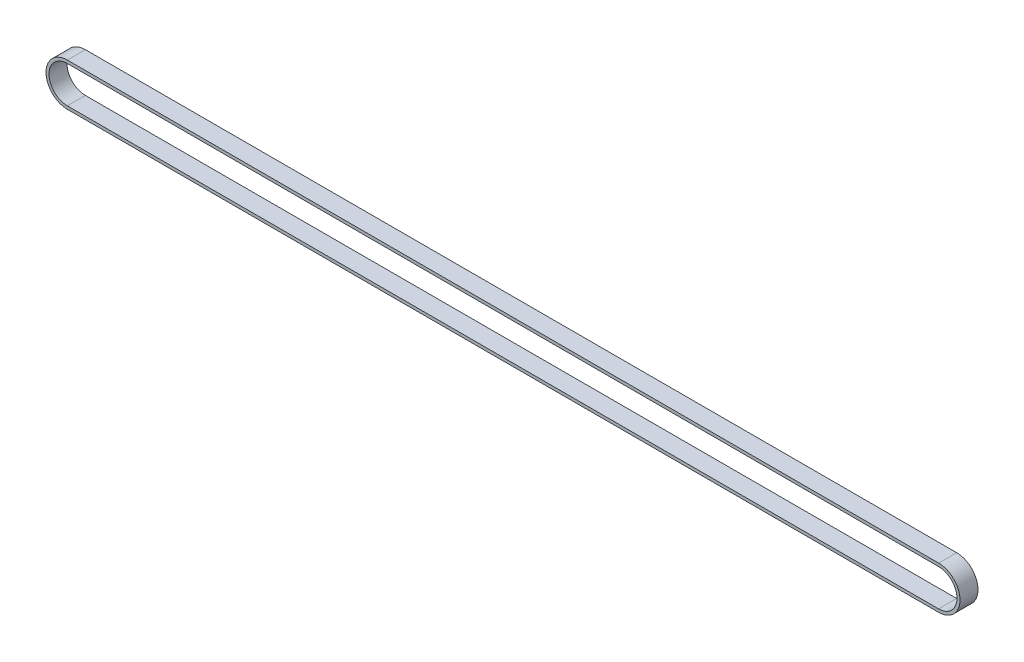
SolidWorks part; units mm, degrees
ref_plane "Спереди" through (0, 0, 0) normal (0, 0, 1) x (1, 0, 0)
ref_plane "Сверху" through (0, 0, 0) normal (0, 1, 0) x (1, 0, 0)
ref_plane "Справа" through (0, 0, 0) normal (1, 0, 0) x (0, 0, -1)
sketch "Эскиз1" plane through (0, 0, 0) normal (0, 0, 1) x (1, 0, 0)
  line L0 (0, 6.1) -> (290, 6.1)
  line L1 (0, -6.1) -> (290, -6.1)
  line L2 (0, 7.1) -> (290, 7.1)
  line L3 (0, -7.1) -> (290, -7.1)
  arc A0 (0, 6.1) -> (0, -6.1) centre (0, 0) ccw
  arc A1 (290, -6.1) -> (290, 6.1) centre (290, 0) ccw
  arc A2 (290, -7.1) -> (290, 7.1) centre (290, 0) ccw
  arc A3 (0, 7.1) -> (0, -7.1) centre (0, 0) ccw
  dimension "D1" = 290
  dimension "D2" = 6.1
  dimension "D3" = 1
extrude "Бобышка-Вытянуть1" add sketch "Эскиз1" along normal blind 6
